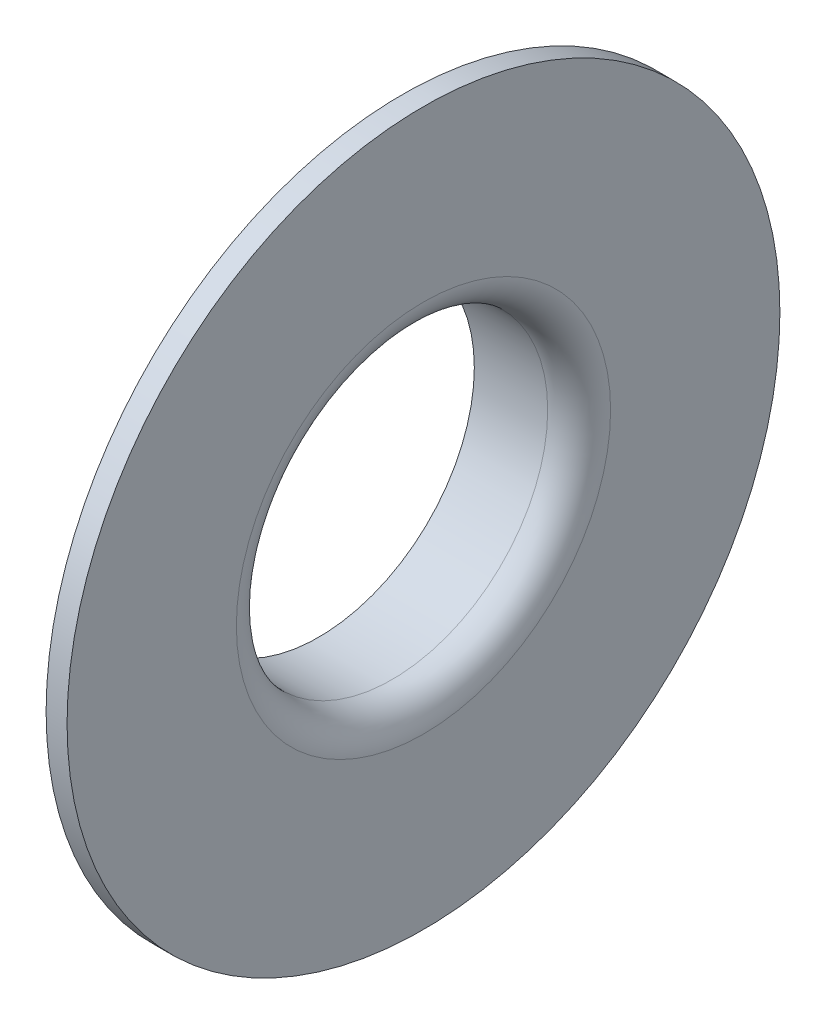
SolidWorks part; units mm, degrees
ref_plane "Plan1" through (0, 0, 0) normal (0, 0, 1) x (1, 0, 0)
ref_plane "Plan2" through (0, 0, 0) normal (0, 1, 0) x (1, 0, 0)
ref_plane "Plan3" through (0, 0, 0) normal (1, 0, 0) x (0, 0, -1)
sketch "Esquisse1" plane through (0, 0, 0) normal (0, 0, 1) x (1, 0, 0)
  line L0 (0, 0) -> (63, 0) construction
  line L1 (0, 16.85) -> (7, 16.85)
  line L2 (8, 17.85) -> (8, 34)
  arc A0 (8, 17.85) -> (7, 16.85) centre (7, 17.85) cw
  dimension "D1" = 1
  dimension "D2" = 33.7
  dimension "D3" = 68
  dimension "D4" = 8
revolve "Base-Révol.-Mince" add sketch "Esquisse1" angle 360 about L0
